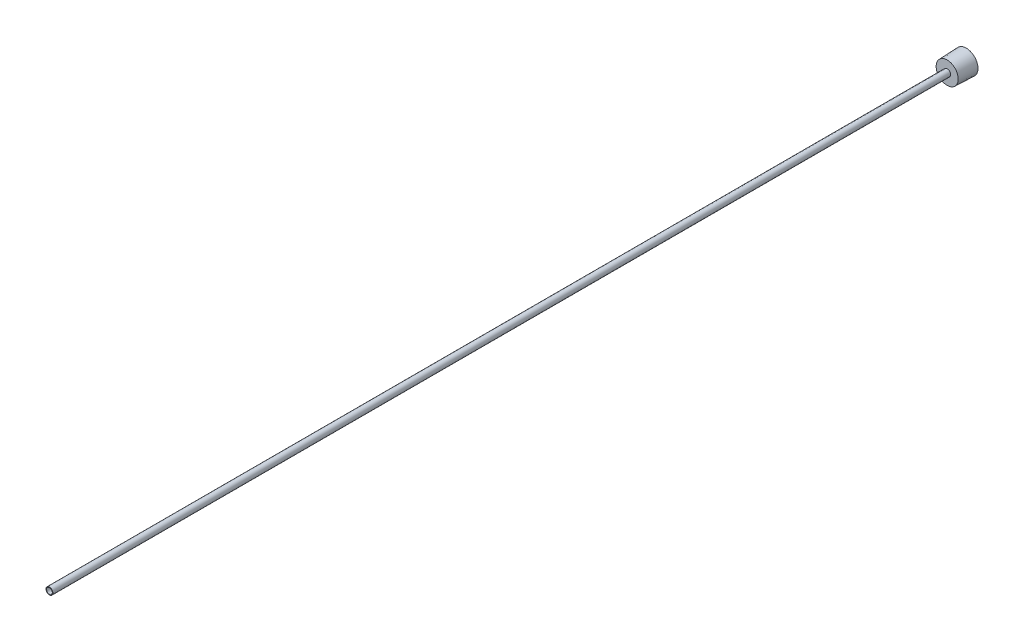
SolidWorks part; units mm, degrees
ref_plane "Front Plane" through (0, 0, 0) normal (0, 0, 1) x (1, 0, 0)
ref_plane "Top Plane" through (0, 0, 0) normal (0, 1, 0) x (1, 0, 0)
ref_plane "Right Plane" through (0, 0, 0) normal (1, 0, 0) x (0, 0, -1)
sketch "Sketch1" plane through (0, 0, 0) normal (1, 0, 0) x (0, 0, -1)
  line L0 (-304.8, 0) -> (0, 0)
  line L5 (0, 3.8989) -> (-6.35, 3.6674)
  line L6 (0, 0) -> (0, 3.8989)
  line L7 (-6.35, 3.6674) -> (-6.35, 1.143)
  line L8 (-6.35, 1.143) -> (-304.8, 1.143)
  line L9 (-304.8, 1.143) -> (-304.8, 0)
  line L10 (0, 0) -> (49989.3417, 0) construction
  dimension "D1" = 2.088
  dimension "D2" = 6.35
  dimension "D3" = 304.8
  dimension "D4" = 2.286
  dimension "D5" = 7.7978
revolve "Revolve1" add sketch "Sketch1" angle 360 about L10
sketch "Sketch2" plane through (0, 0, 304.8) normal (0, 0, 1) x (1, 0, 0)
  circle A0 centre (0, 0) radius 0.9652
  dimension "D1" = 1.9304
extrude "Cut-Extrude1" cut sketch "Sketch2" against normal through all
sketch "Sketch3" plane through (0, 0, 0) normal (0, 0, -1) x (-1, 0, 0)
  line L0 (0, 4.2888) -> (0, -4.2888) construction
  line L1 (0, -2.7496) -> (2.3812, -1.3748)
  line L2 (2.3812, -1.3748) -> (2.3812, 1.3748)
  line L3 (2.3812, 1.3748) -> (0, 2.7496)
  line L4 (0, 2.7496) -> (-2.3813, 1.3748)
  line L5 (-2.3813, 1.3748) -> (-2.3813, -1.3748)
  line L6 (-2.3813, -1.3748) -> (0, -2.7496)
  circle A0 centre (0, 0) radius 2.3813 construction
  dimension "D1" = 4.7625
extrude "Cut-Extrude2" cut sketch "Sketch3" against normal blind 3.9688
